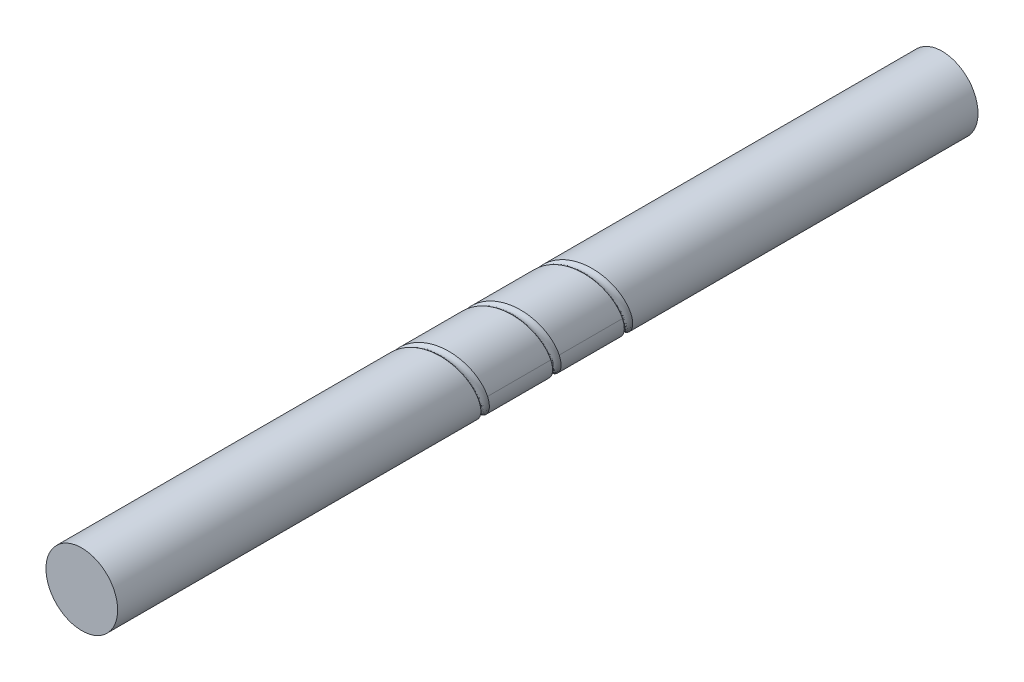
SolidWorks part; units mm, degrees
ref_plane "Front Plane" through (0, 0, 0) normal (0, 0, 1) x (1, 0, 0)
ref_plane "Top Plane" through (0, 0, 0) normal (0, 1, 0) x (1, 0, 0)
ref_plane "Right Plane" through (0, 0, 0) normal (1, 0, 0) x (0, 0, -1)
sketch "Sketch1" plane through (0, 0, 0) normal (0, 0, 1) x (1, 0, 0)
  circle A0 centre (0, 0) radius 25
  dimension "D1" = 50
extrude "Boss-Extrude1" add sketch "Sketch1" along normal blind 600
ref_plane "Plane1" through (0, 0, 220) normal (0, 0, 1) x (1, 0, 0)
sketch "Sketch2" plane through (0, 0, 220) normal (0, 0, 1) x (1, 0, 0)
  circle A0 centre (0, 0) radius 27.646
  dimension "D1" = 55.292
curve "Helix/Spiral1"
sketch "Sketch3" plane through (0, 0, 0) normal (0, 1, 0) x (1, 0, 0)
  circle A0 centre (-27.646, -220) radius 3.969
  spline S0 degree 3 number of poles 79 (-27.646, -220) -> (-8.5431, -380) construction
  dimension "D1" = 7.938
sweep "Cut-Sweep1" cut profiles "Sketch3" path "Helix/Spiral1"
pattern_linear "LPattern1" [suppressed] count 2 spacing 500
